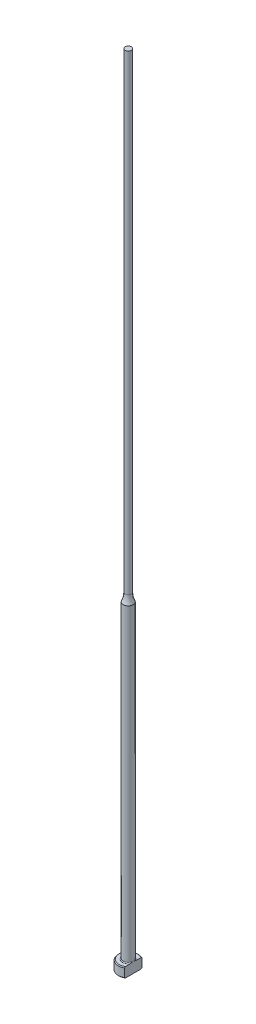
SolidWorks part; units mm, degrees
ref_plane "Front Plane" through (0, 0, 0) normal (0, 0, 1) x (1, 0, 0)
ref_plane "Top Plane" through (0, 0, 0) normal (0, 1, 0) x (1, 0, 0)
ref_plane "Right Plane" through (0, 0, 0) normal (1, 0, 0) x (0, 0, -1)
sketch "Sketch1" plane through (0, 0, 0) normal (0, 0, 1) x (1, 0, 0)
  line L0 (0, 259.9588) -> (0, -15.1925) construction
  line L1 (0, 0) -> (-3.175, 0)
  line L2 (-3.175, 0) -> (-3.175, 3.175)
  line L3 (-3.175, 3.175) -> (-1.5875, 3.175)
  line L4 (-0.9919, 104.2851) -> (-0.9919, 254)
  line L5 (-0.9919, 254) -> (0, 254)
  line L6 (0, 254) -> (0, 0)
  line L7 (-1.5875, 3.175) -> (-1.5875, 101.6)
  arc A0 (-1.5875, 101.6) -> (-0.9919, 104.2851) centre (-7.3419, 104.2851) ccw
  point P13 (-1.5875, 0)
  dimension "D1" = 6.35
  dimension "L" = 254
  dimension "D2" = 3.175
  dimension "H" = 6.35
  dimension "T" = 3.175
  dimension "D" = 1.9837
  dimension "S" = 101.6
revolve "Revolve1" add sketch "Sketch1" angle 360 about L0
chamfer "Chamfer1" distance 0.254 angle 45 2 edges at (0, 3.175, 3.175) (0, 0, 3.175)
fillet "Fillet1" radius 0.254 1 edges at (0, 3.175, 1.5875)
sketch "Sketch2" plane through (0, 0, 0) normal (0, 1, 0) x (1, 0, 0)
  line L0 (1.5875, -2.7496) -> (1.5875, 2.7496)
  circle A0 centre (0, 0) radius 3.175 construction
  arc A2 (1.5875, -2.7496) -> (1.5875, 2.7496) centre (0, 0) ccw
  circle A3 centre (0, 0) radius 3.175 construction
  circle A4 centre (0, 0) radius 1.5875 construction
extrude "Key Head" cut sketch "Sketch2" along normal up to next
